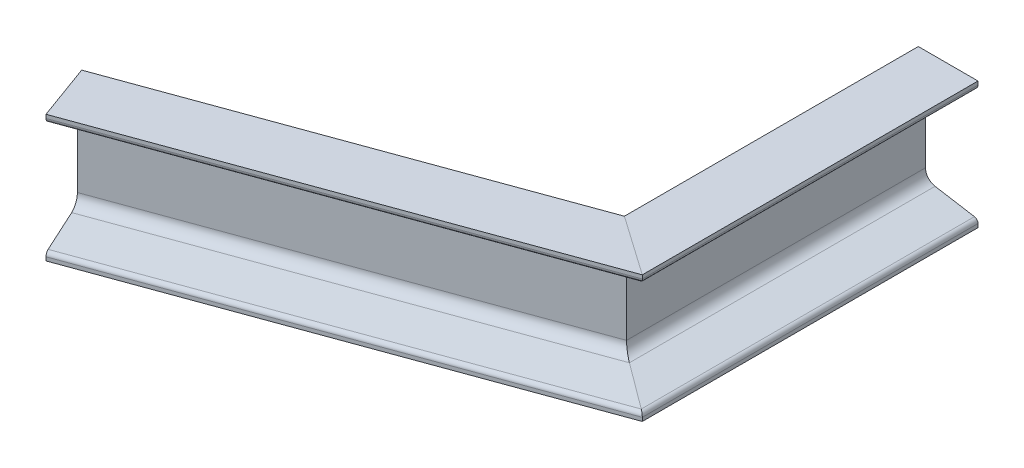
SolidWorks part; units mm, degrees
ref_plane "Front Plane" through (0, 0, 0) normal (0, 0, 1) x (1, 0, 0)
ref_plane "Top Plane" through (0, 0, 0) normal (0, 1, 0) x (1, 0, 0)
ref_plane "Right Plane" through (0, 0, 0) normal (1, 0, 0) x (0, 0, -1)
sketch "Sketch1" plane through (0, 0, 0) normal (0, 0, 1) x (1, 0, 0)
  line L0 (0, 0) -> (0, 76.2)
  line L1 (0, 76.2) -> (35.814, 76.2)
  line L2 (0, 0) -> (35.814, 0)
  line L12 (4.318, 60.8314) -> (4.318, 15.3686)
  line L15 (35.814, 76.2) -> (35.814, 74.0423)
  line L16 (35.814, 0) -> (35.814, 2.1577)
  line L17 (10.0485, 67.5961) -> (33.6916, 71.5369)
  line L18 (10.0485, 8.6039) -> (33.6916, 4.6631)
  arc A9 (4.318, 15.3686) -> (10.0485, 8.6039) centre (11.176, 15.3686) ccw
  arc A10 (4.318, 60.8314) -> (10.0485, 67.5961) centre (11.176, 60.8314) cw
  arc A11 (35.814, 74.0423) -> (33.6916, 71.5369) centre (33.274, 74.0423) cw
  arc A12 (35.814, 2.1577) -> (33.6916, 4.6631) centre (33.274, 2.1577) ccw
sketch "Sketch2" plane through (0, 0, 0) normal (0, 1, 0) x (1, 0, 0)
  line L0 (0, 0) -> (0, -176.2959)
  line L1 (0, -176.2959) -> (-238.6819, -263.169)
  line L2 (0, -176.2959) -> (-131.3748, -84.3062) construction
  dimension "D1" = 110
  dimension "D2" = 254
  dimension "D3" = 55
ref_plane "Plane1" through (-238.6819, 0, 263.169) normal (-0.9397, 0, 0.342) x (0.342, 0, 0.9397)
sketch "Sketch3" plane through (-238.6819, 0, 263.169) normal (-0.9397, 0, 0.342) x (0.342, 0, 0.9397)
  line L0 (0, 0) -> (0, 76.2)
  line L1 (0, 76.2) -> (35.814, 76.2)
  line L2 (0, 0) -> (35.814, 0)
  line L12 (4.318, 60.8314) -> (4.318, 15.3686)
  line L15 (35.814, 76.2) -> (35.814, 74.0423)
  line L16 (35.814, 0) -> (35.814, 2.1577)
  line L17 (10.0485, 67.5961) -> (33.6916, 71.5369)
  line L18 (10.0485, 8.6039) -> (33.6916, 4.6631)
  arc A9 (4.318, 15.3686) -> (10.0485, 8.6039) centre (11.176, 15.3686) ccw
  arc A10 (4.318, 60.8314) -> (10.0485, 67.5961) centre (11.176, 60.8314) cw
  arc A11 (35.814, 74.0423) -> (33.6916, 71.5369) centre (33.274, 74.0423) cw
  arc A12 (35.814, 2.1577) -> (33.6916, 4.6631) centre (33.274, 2.1577) ccw
  dimension "D4" = 2.54
  dimension "D5" = 6.858
  dimension "D2" = 9.463
  dimension "D1" = 76.2
  dimension "D3" = 35.814
  dimension "D6" = 4.318
  dimension "D7" = 2.1577
ref_plane "Plane2" through (-131.3748, 0, 84.3062) normal (-0.8192, 0, -0.5736) x (-0.5736, 0, 0.8192)
sketch "Sketch4" plane through (-131.3748, 0, 84.3062) normal (-0.8192, 0, -0.5736) x (-0.5736, 0, 0.8192)
  line L0 (0, 0) -> (0, 76.8835) construction
ref_plane "Plane3" through (-82.832, 0, 118.2963) normal (0.5736, 0, -0.8192) x (-0.8192, 0, -0.5736)
extrude "Extrude1" add sketch "Sketch3" against normal up to surface (254 mm away)
extrude "Extrude2" add sketch "Sketch1" along normal up to surface (176.2959 mm away) separate body
